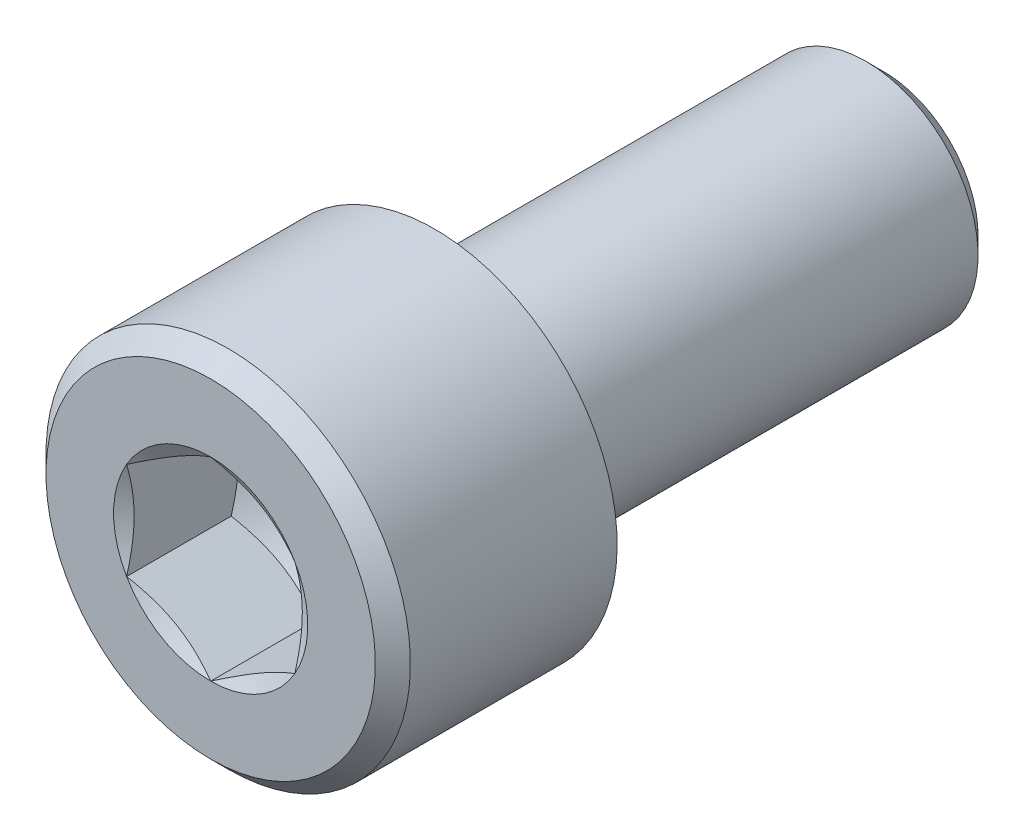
SolidWorks part; units mm, degrees
ref_plane "Front" through (0, 0, 0) normal (0, 0, 1) x (1, 0, 0)
ref_plane "Top" through (0, 0, 0) normal (0, 1, 0) x (1, 0, 0)
ref_plane "Right" through (0, 0, 0) normal (1, 0, 0) x (0, 0, -1)
sketch "Sketch1" plane through (0, 0, 0) normal (1, 0, 0) x (0, 0, -1)
  line L0 (0, 6.5) -> (-8, 6.5)
  line L1 (-8, 6.5) -> (-8, 0)
  line L2 (-8, 0) -> (16, 0)
  line L3 (16, 0) -> (16, 4)
  line L4 (16, 4) -> (0, 4)
  line L5 (0, 4) -> (0, 6.5)
  line L6 (0, 0) -> (12.7561, 0) construction
  dimension "l" = 16
  dimension "d" = 8
  dimension "k" = 8
  dimension "dk" = 13
revolve "Revolve1" add sketch "Sketch1" angle 360 about L2
sketch "Sketch7" plane through (0, 0, 0) normal (1, 0, 0) x (0, 0, -1)
  line L0 (-6.6396, 0) -> (3.6195, 0) construction
  line L1 (-8, 0) -> (-8, 3)
  line L2 (-8, 6.5) -> (-8, -6.5) construction
  line L3 (-8, 3) -> (-4, 3)
  line L4 (-4, 3) -> (-2.2679, 0)
  line L6 (-8, 0) -> (-2.2679, 0)
  dimension "D1" = 60
  dimension "S" = 6
  dimension "t" = 4
revolve "Cut-Revolve2" cut sketch "Sketch7" angle 360 about L6
chamfer "Chamfer1" distance 0.625 2 edges at (0, -4, -16) (0, -6.5, 8)
sketch "Sketch8" plane through (0, 0, 8) normal (0, 0, 1) x (1, 0, 0)
  line L1 (0, 3.4641) -> (-3, 1.7321)
  line L2 (-3, 1.7321) -> (-3, -1.7321)
  line L3 (-3, -1.7321) -> (0, -3.4641)
  line L4 (0, -3.4641) -> (3, -1.7321)
  line L5 (3, -1.7321) -> (3, 1.7321)
  line L6 (3, 1.7321) -> (0, 3.4641)
  circle A0 centre (0, 0) radius 3 construction
  circle A1 centre (0, 0) radius 3 construction
extrude "Cut-Extrude1" cut sketch "Sketch8" against normal up to surface (3.7321 mm away)
sketch "Sketch9" plane through (0, 0, 0) normal (1, 0, 0) x (0, 0, -1)
  line L0 (-8, 3) -> (4.2695, 3) construction
  line L3 (-8.5, 4.3301) -> (-8.5, 3)
  line L4 (-8.5, 3) -> (-7.7321, 3)
  line L5 (-7.7321, 3) -> (-8.5, 4.3301)
  line L6 (-8, 6.5) -> (-8, -6.5) construction
  dimension "D1" = 60
  dimension "D2" = 0.5
revolve "Cut-Revolve3" cut sketch "Sketch9" angle 360 about axis through (0, 0, 8) along (0, 0, -1)
fillet "Fillet2" radius 0.4 1 edges at (0, -4, 0)
